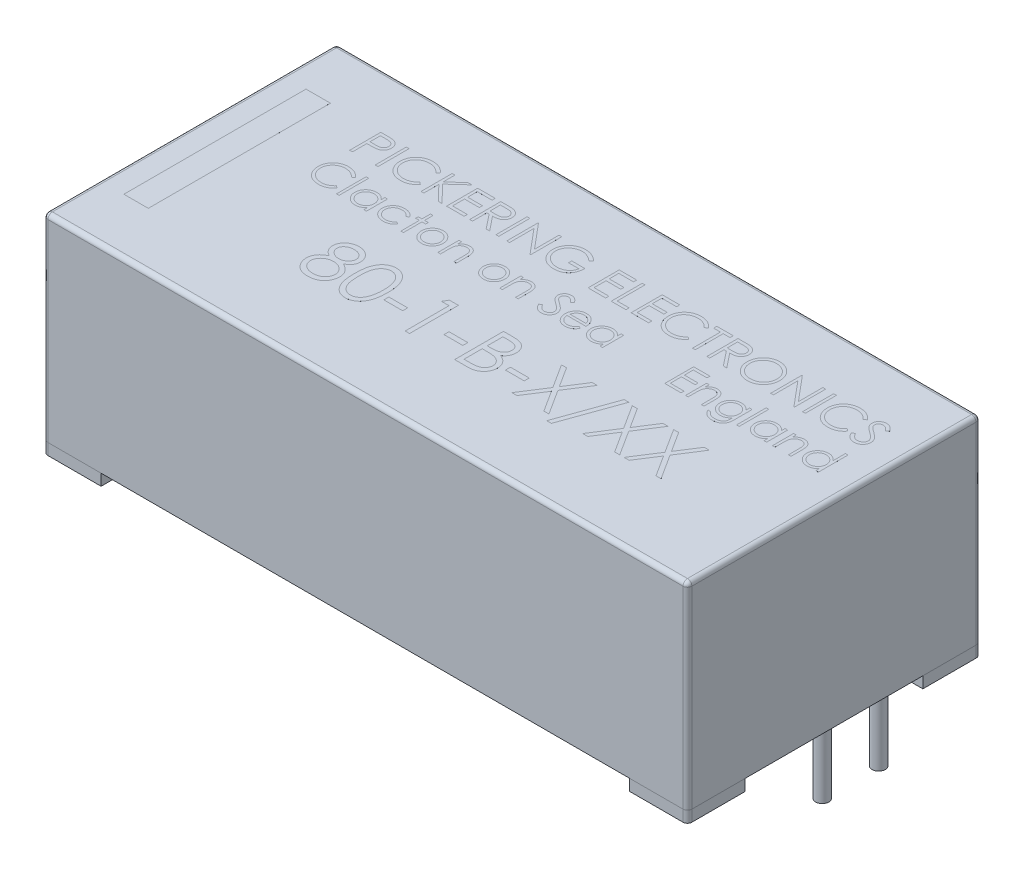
SolidWorks part; units mm, degrees
ref_plane "Front Plane" through (0, 0, 0) normal (0, 0, 1) x (1, 0, 0)
ref_plane "Top Plane" through (0, 0, 0) normal (0, 1, 0) x (1, 0, 0)
ref_plane "Right Plane" through (0, 0, 0) normal (1, 0, 0) x (0, 0, -1)
sketch "Sketch2" plane through (0, 0, 0) normal (0, 1, 0) x (1, 0, 0)
  line L1 (14.5, -6.6) -> (-14.5, -6.6)
  line L2 (14.5, -6.6) -> (14.5, 6.6)
  line L3 (14.5, 6.6) -> (-14.5, 6.6)
  line L4 (-14.5, -6.6) -> (-14.5, 6.6)
  line L5 (14.5, -6.6) -> (-14.5, 6.6) construction
  line L6 (14.5, 6.6) -> (-14.5, -6.6) construction
  point P0 (0, 0)
  dimension "D1" = 13.2
  dimension "D2" = 29
extrude "Main Body" add sketch "Sketch2" along normal blind 8.89 draft 0.023
sketch "Sketch9" plane through (0, 0, 0) normal (0, -1, 0) x (1, 0, 0)
  line L0 (14.5, -6.6) -> (-14.5, -6.6) construction
  line L1 (14.5, 6.6) -> (14.5, -6.6) construction
  circle A0 centre (12.7, -3.81) radius 0.3
  circle A1 centre (12.7, -1.27) radius 0.2963
  dimension "D1" = 0.6
  dimension "D2" = 2.79
  dimension "D3" = 2.54
  dimension "D4" = 1.8
extrude "Pins" add sketch "Sketch9" along normal blind 4.31
mirror "Mirror2" about plane through (0, 0, 0) normal (1, 0, 0) of "Pins"
sketch "Sketch10" plane through (0, 0, 0) normal (0, -1, 0) x (1, 0, 0)
  line L1 (14.5, 6.6) -> (11.9, 6.6)
  line L2 (14.5, 6.6) -> (14.5, 4)
  line L3 (14.5, 4) -> (11.9, 4)
  line L4 (11.9, 6.6) -> (11.9, 4)
  dimension "D1" = 2.6
  dimension "D2" = 2.6
extrude "Foot" add sketch "Sketch10" along normal blind 0.51
sketch "Sketch11" plane through (0, -0.51, 0) normal (0, -1, 0) x (1, 0, 0)
  line L0 (14.5, 6.6) -> (11.9, 6.6) construction
  line L1 (11.9, 4) -> (13.95, 4)
  line L2 (11.9, 4) -> (11.9, 6.05)
  line L3 (11.9, 6.05) -> (13.95, 6.05)
  line L4 (13.95, 4) -> (13.95, 6.05)
  line L5 (14.5, 4) -> (14.5, 6.6) construction
  dimension "D1" = 0.55
  dimension "D2" = 0.55
extrude "Extrude2" cut sketch "Sketch11" against normal up to surface (0.51 mm away)
mirror "Mirror3" about plane through (0, 0, 0) normal (0, 0, 1) of "Extrude2", "Foot"
mirror "Mirror4" about plane through (0, 0, 0) normal (1, 0, 0) of "Mirror3", "Foot", "Extrude2"
sketch "Sketch12"
  dimension "D1" = 1.1
  dimension "D2" = 8.2
  dimension "D3" = 2.4965
  dimension "D4" = 1.4
  dimension "D5" = 2
  dimension "D6" = 3.8
extrude "Lettering" add sketch "Sketch12" along normal blind 0.0001
fillet "Fillet1" radius 0.2 12 edges at (-14.5, -0.255, -6.6) (14.5, -0.255, -6.6) (14.5, -0.255, 6.6) (-14.5, -0.255, 6.6) (-14.4983, 4.445, -6.5983) (14.4983, 4.445, -6.5983) (14.4983, 4.445, 6.5983) (14.4965, 8.89, 0) (0, 8.89, -6.5965) (-14.4965, 8.89, 0) (-14.4983, 4.445, 6.5983) (0, 8.89, 6.5965)
